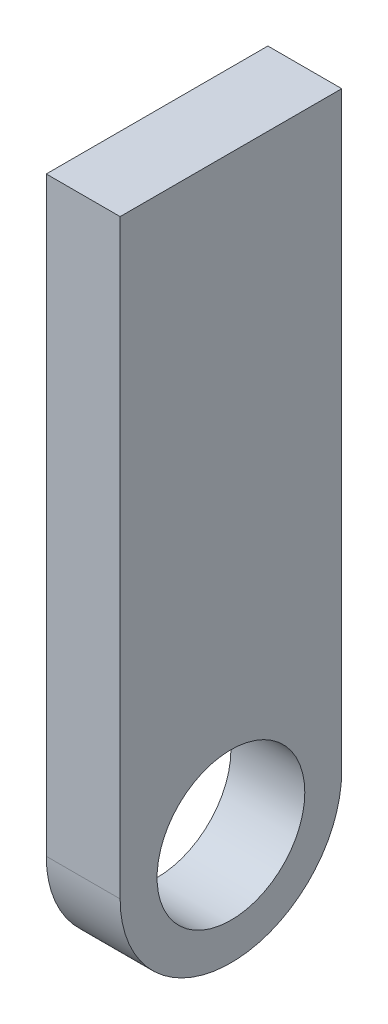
SolidWorks part; units mm, degrees
ref_plane "前视基准面" through (0, 0, 0) normal (0, 0, 1) x (1, 0, 0)
ref_plane "上视基准面" through (0, 0, 0) normal (0, 1, 0) x (1, 0, 0)
ref_plane "右视基准面" through (0, 0, 0) normal (1, 0, 0) x (0, 0, -1)
sketch "草图1" plane through (0, 0, 0) normal (1, 0, 0) x (0, 0, -1)
  line L0 (-15, 0) -> (-15, 80)
  line L1 (-15, 80) -> (15, 80)
  line L2 (15, 80) -> (15, 0)
  circle A0 centre (0, 0) radius 10
  arc A1 (-15, 0) -> (15, 0) centre (0, 0) ccw
  dimension "D1" = 15
  dimension "D2" = 20
  dimension "D3" = 80
extrude "凸台-拉伸1" add sketch "草图1" along normal blind 10
